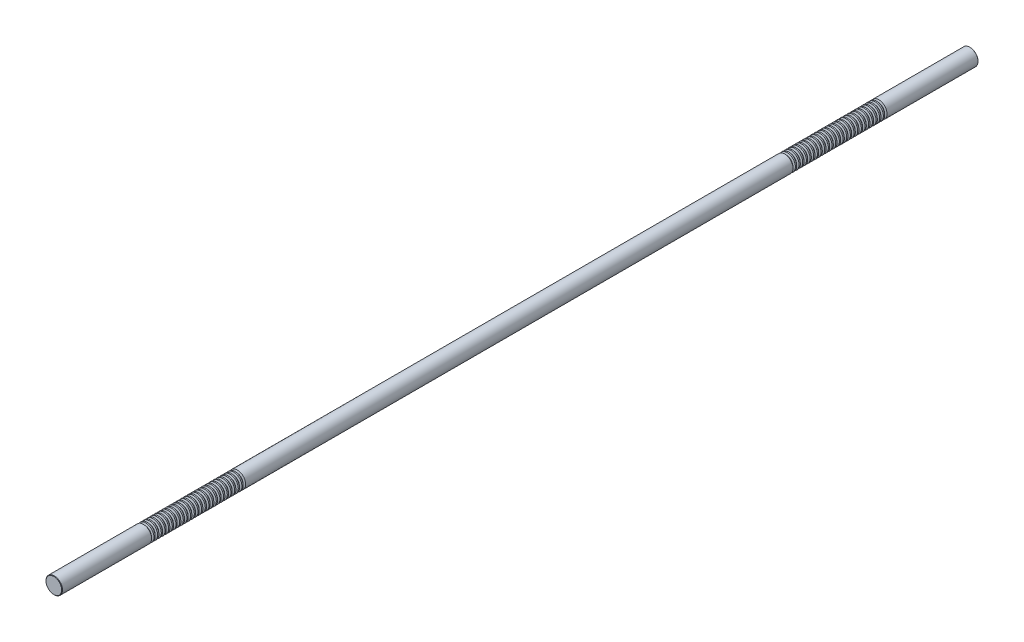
SolidWorks part; units mm, degrees
ref_plane "Front Plane" through (0, 0, 0) normal (0, 0, 1) x (1, 0, 0)
ref_plane "Top Plane" through (0, 0, 0) normal (0, 1, 0) x (1, 0, 0)
ref_plane "Right Plane" through (0, 0, 0) normal (1, 0, 0) x (0, 0, -1)
sketch "Sketch1" plane through (0, 0, 0) normal (0, 0, 1) x (1, 0, 0)
  circle A0 centre (0, 0) radius 9
  dimension "D1" = 18
extrude "Boss-Extrude1" add sketch "Sketch1" along normal mid plane 1000
chamfer "Chamfer1" distance 0.45 angle 45 2 edges at (9, 0, -500) (9, 0, 500)
sketch "Sketch2" plane through (0, 0, 0) normal (1, 0, 0) x (0, 0, -1)
  line L0 (400.3014, 9) -> (397.6986, 9)
  line L1 (499.55, 9) -> (-499.55, 9) construction
  line L2 (397.6986, 9) -> (398.3014, 6.75)
  line L3 (398.3014, 6.75) -> (399.6986, 6.75)
  line L4 (399.6986, 6.75) -> (400.3014, 9)
  line L5 (500, -8.55) -> (500, 8.55) construction
  point P4 (399, 9)
  point P7 (399, 6.75)
  point P8 (400, 7.875)
  point P9 (398, 7.875)
  dimension "D1" = 2
  dimension "D2" = 100
  dimension "D3" = 2.25
  dimension "D4" = 30
revolve "Cut-Revolve1" cut sketch "Sketch2" angle 360 about axis through (0, 0, 500) along (0, 0, -1)
pattern_linear "LPattern1" count 26 spacing 4 along (0, 0, 1) of "Cut-Revolve1"
pattern_linear "LPattern2" count 2 spacing 700 along (0, 0, 1) of "Cut-Revolve1", "LPattern1"
